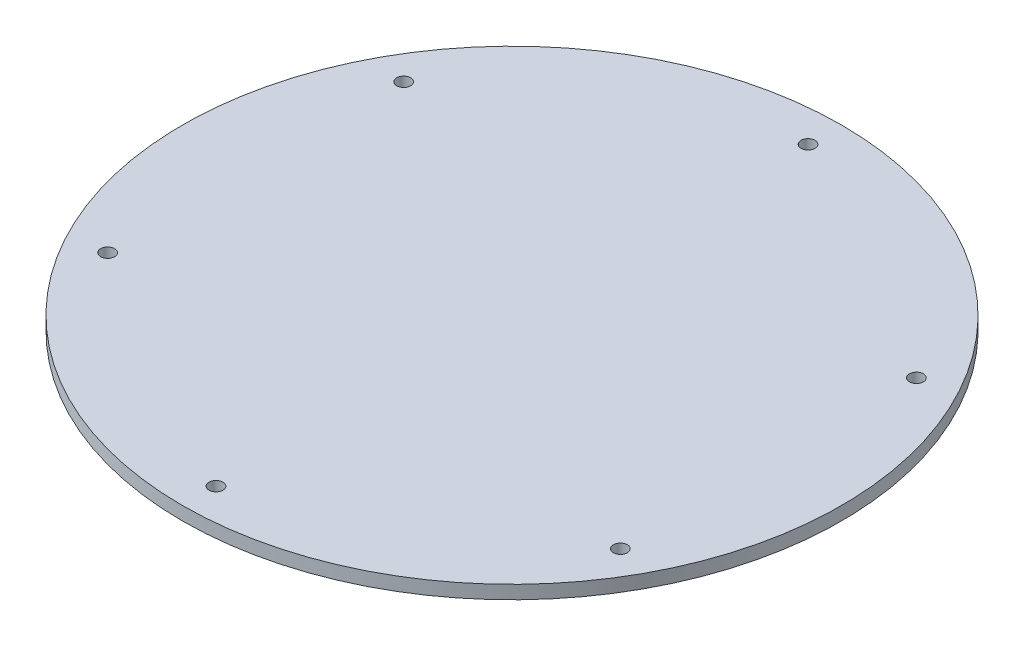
SolidWorks part; units mm, degrees
ref_plane "Front Plane" through (0, 0, 0) normal (0, 0, 1) x (1, 0, 0)
ref_plane "Top Plane" through (0, 0, 0) normal (0, 1, 0) x (1, 0, 0)
ref_plane "Right Plane" through (0, 0, 0) normal (1, 0, 0) x (0, 0, -1)
sketch "Sketch1" plane through (0, 0, 0) normal (0, 1, 0) x (1, 0, 0)
  circle A0 centre (0, 0) radius 149.86
  circle A1 centre (-116.5843, -67.31) radius 3.175
  circle A2 centre (-116.5843, 67.31) radius 3.175
  circle A3 centre (0, 134.62) radius 3.175
  circle A4 centre (116.5843, 67.31) radius 3.175
  circle A5 centre (116.5843, -67.31) radius 3.175
  circle A6 centre (0, -134.62) radius 3.175
  point P3 (0, -134.62)
  point P7 (-116.5843, -67.31)
  point P8 (-116.5843, 67.31)
  point P9 (0, 134.62)
  point P10 (116.5843, 67.31)
  point P11 (116.5843, -67.31)
  dimension "D1" = 134.62
  dimension "D3" = 6
  dimension "D2" = 6
extrude "Boss-Extrude2" add sketch "Sketch1" along normal blind 6.096
